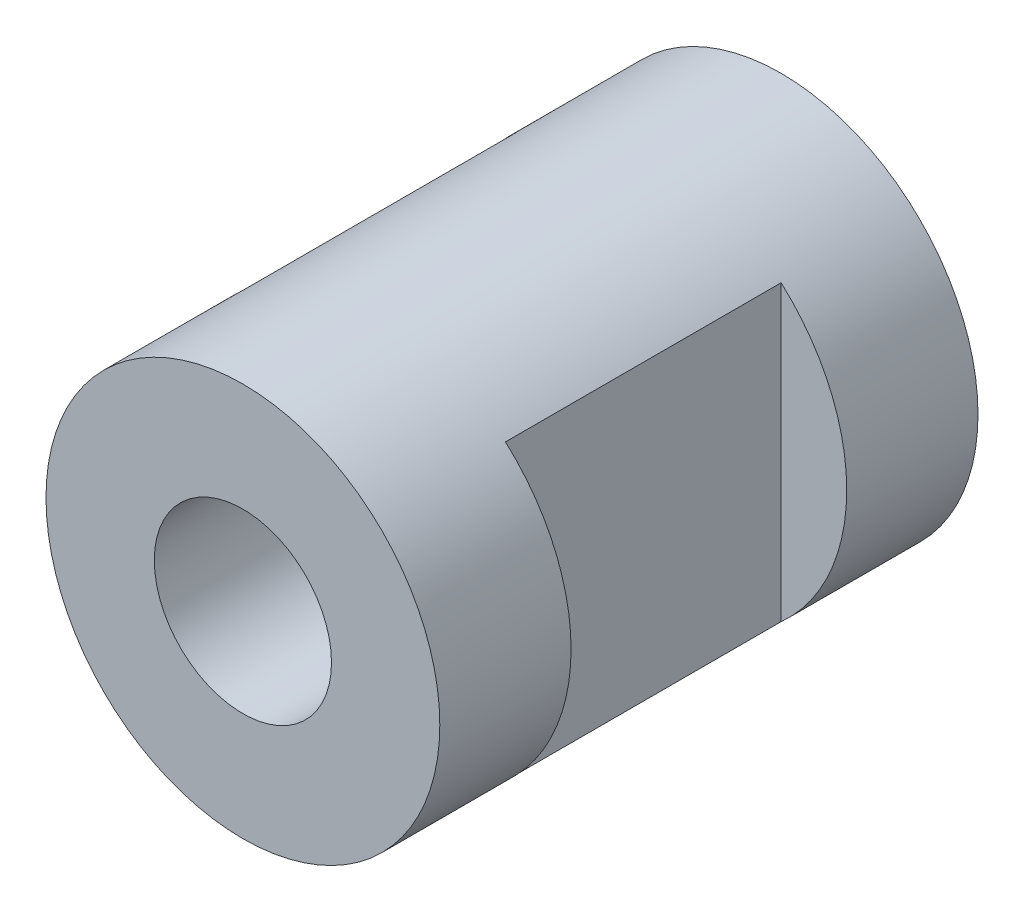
SolidWorks part; units mm, degrees
ref_plane "前视基准面" through (0, 0, 0) normal (0, 0, 1) x (1, 0, 0)
ref_plane "上视基准面" through (0, 0, 0) normal (0, 1, 0) x (1, 0, 0)
ref_plane "右视基准面" through (0, 0, 0) normal (1, 0, 0) x (0, 0, -1)
sketch "草图1" plane through (0, 0, 0) normal (0, 0, 1) x (1, 0, 0)
  circle A0 centre (0, 0) radius 7.5
  circle A1 centre (0, 0) radius 3.375
extrude "凸台-拉伸1" add sketch "草图1" along normal blind 20.5
ref_plane "基准面2" through (0, 7.5, 0) normal (0, 1, 0) x (-1, 0, 0)
sketch "草图4" plane through (0, 7.5, 0) normal (0, 1, 0) x (-1, 0, 0)
  line L0 (-7.5, 20.5) -> (-7.5, 0) construction
  line L1 (-8.5996, 15.5) -> (-5, 15.5)
  line L2 (-8.5996, 15.5) -> (-8.5996, 5)
  line L3 (-8.5996, 5) -> (-5, 5)
  line L4 (-5, 15.5) -> (-5, 5)
  line L5 (0, 10.25) -> (-14.9803, 10.25) construction
  line L8 (8.5996, 5) -> (5, 5)
  line L9 (0, 20.5) -> (0, 0) construction
  line L10 (3.375, 20.5) -> (-3.375, 20.5) construction
  line L11 (5, 15.5) -> (5, 5)
  line L12 (8.5996, 15.5) -> (8.5996, 5)
  line L13 (8.5996, 15.5) -> (5, 15.5)
  dimension "D1" = 10.5
  dimension "D2" = 2.5
extrude "切除-拉伸1" cut sketch "草图4" against normal blind 20.5
